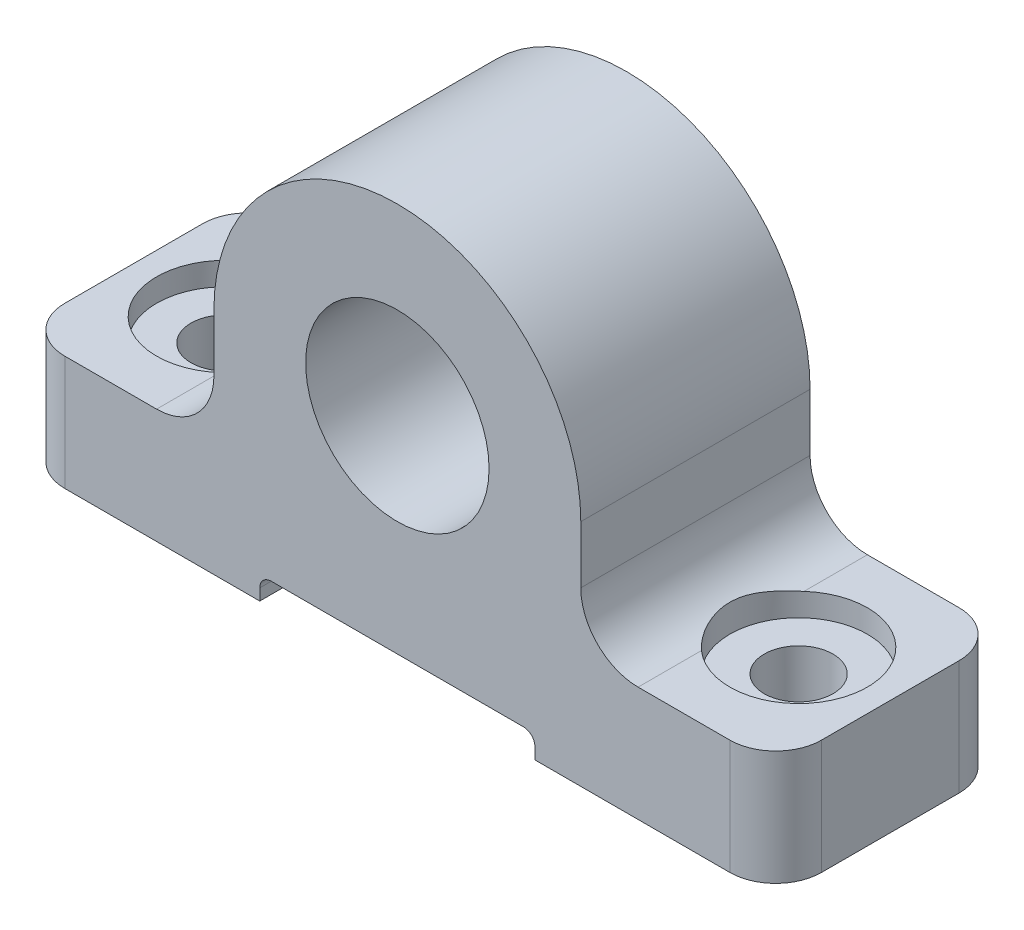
SolidWorks part; units mm, degrees
ref_plane "前视基准面" through (0, 0, 0) normal (0, 0, 1) x (1, 0, 0)
ref_plane "上视基准面" through (0, 0, 0) normal (0, 1, 0) x (1, 0, 0)
ref_plane "右视基准面" through (0, 0, 0) normal (1, 0, 0) x (0, 0, -1)
sketch "草图1" plane through (0, 0, 0) normal (0, 0, 1) x (1, 0, 0)
  line L0 (0, 51.5471) -> (0, -69.1029) construction
  line L1 (-68.2941, -8.7779) -> (119.9647, -8.7779) construction
  line L2 (-12, -28.7779) -> (-33, -28.7779)
  line L3 (-33, -28.7779) -> (-33, -18.7779)
  line L4 (11, -26.7779) -> (-11, -26.7779)
  line L5 (-12, -27.7779) -> (-12, -28.7779)
  line L6 (-33, -18.7779) -> (-21, -18.7779)
  line L7 (-16, -13.7779) -> (-16, -8.7779)
  line L8 (12, -27.7779) -> (12, -28.7779)
  line L9 (12, -28.7779) -> (33, -28.7779)
  line L10 (33, -28.7779) -> (33, -18.7779)
  line L11 (33, -18.7779) -> (21, -18.7779)
  line L12 (16, -13.7779) -> (16, -8.7779)
  circle A0 centre (0, -8.7779) radius 8
  arc A1 (-16, -8.7779) -> (16, -8.7779) centre (0, -8.7779) cw
  arc A2 (-11, -26.7779) -> (-12, -27.7779) centre (-11, -27.7779) ccw
  arc A3 (-21, -18.7779) -> (-16, -13.7779) centre (-21, -13.7779) ccw
  arc A4 (11, -26.7779) -> (12, -27.7779) centre (11, -27.7779) cw
  arc A5 (21, -18.7779) -> (16, -13.7779) centre (21, -13.7779) cw
  point P16 (-12, -26.7779)
  point P21 (0, -26.7779)
  dimension "D1" = 16
  dimension "D2" = 16
  dimension "D5" = 1
  dimension "D7" = 5
  dimension "D3" = 10
  dimension "D4" = 21
  dimension "D6" = 12
extrude "拉伸1" add sketch "草图1" along normal mid plane 20
sketch "草图3" plane through (0, 0, 0) normal (0, 1, 0) x (1, 0, 0)
  line L0 (-33, 0) -> (31.5196, 0) construction
  line L1 (-33, -10) -> (-33, 10) construction
  line L2 (-25, -14.4118) -> (-25, 8.3333) construction
  line L3 (25, -15.5882) -> (25, 17.2549) construction
  line L4 (33, -10) -> (33, 10) construction
  circle A1 centre (-25, 0) radius 3
  circle A3 centre (25, 0) radius 3
  dimension "D4" = 6
  dimension "D6" = 6
  dimension "D1" = 8
  dimension "D2" = 8
extrude "切除-拉伸1" cut sketch "草图3" against normal through all
sketch "草图5" plane through (0, 0, 0) normal (0, 1, 0) x (1, 0, 0)
  circle A0 centre (-25, 0) radius 6
  circle A1 centre (25, 0) radius 6
  dimension "D1" = 12
  dimension "D2" = 12
extrude "切除-拉伸2" cut sketch "草图5" against normal offset from surface (20.7779 mm away) 8
fillet "圆角1" radius 4 4 edges at (33, -23.7779, -10) (33, -23.7779, 10) (-33, -23.7779, -10) (-33, -23.7779, 10)
